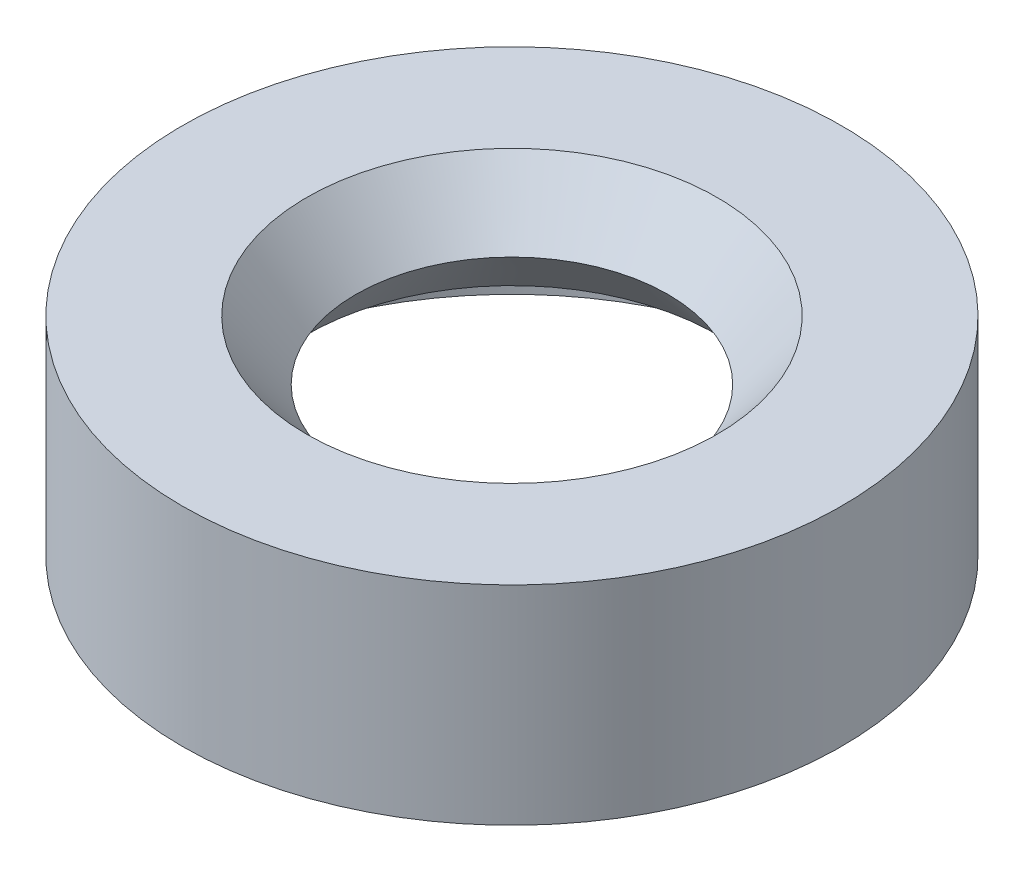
SolidWorks part; units mm, degrees
ref_plane "Front Plane" through (0, 0, 0) normal (0, 0, 1) x (1, 0, 0)
ref_plane "Top Plane" through (0, 0, 0) normal (0, 1, 0) x (1, 0, 0)
ref_plane "Right Plane" through (0, 0, 0) normal (1, 0, 0) x (0, 0, -1)
sketch "Sketch1" plane through (0, 0, 0) normal (0, 0, 1) x (1, 0, 0)
  line L0 (0, 8.2009) -> (0, -8.3091) construction
  line L1 (-9.5, -6) -> (-9.5, 0)
  line L2 (-9.5, 0) -> (-5.9158, 0)
  line L3 (-5.9158, 0) -> (-4.5, -1.7137)
  line L4 (-4.5, -1.7137) -> (-5.9158, -3.4273)
  dimension "D1" = 19
  dimension "D2" = 9
  dimension "D3" = 6
revolve "Revolve-Thin2" add sketch "Sketch1" angle 360 about L0
